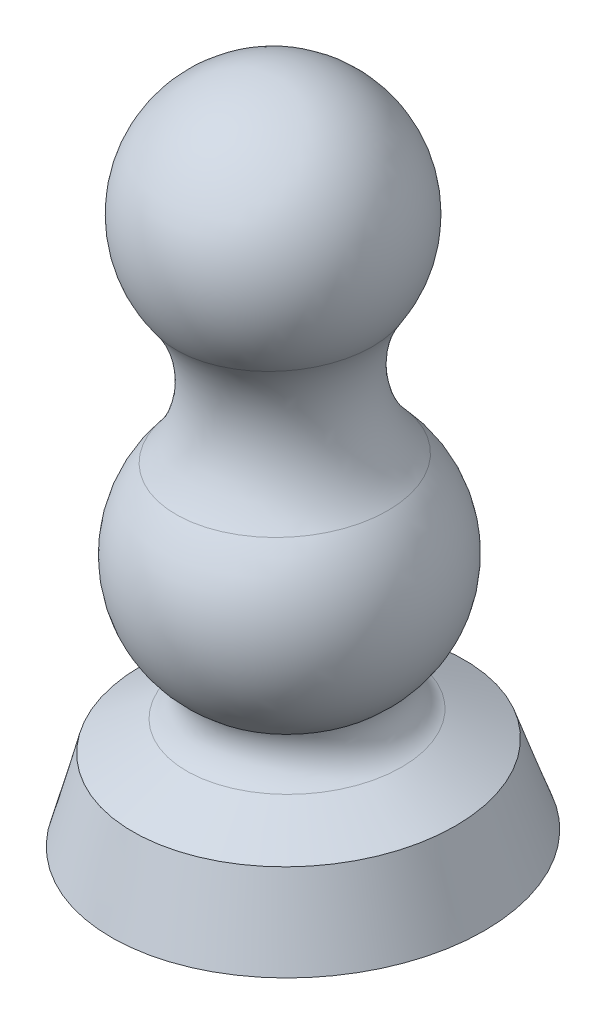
SolidWorks part; units mm, degrees
ref_plane "Front Plane" through (0, 0, 0) normal (0, 0, 1) x (1, 0, 0)
ref_plane "Top Plane" through (0, 0, 0) normal (0, 1, 0) x (1, 0, 0)
ref_plane "Right Plane" through (0, 0, 0) normal (1, 0, 0) x (0, 0, -1)
sketch "Sketch1" plane through (0, 0, 0) normal (0, 0, 1) x (1, 0, 0)
  line L0 (0, 0) -> (-54.2574, 0)
  line L1 (-54.2574, 0) -> (-48.2435, 23.546)
  line L2 (-48.2435, 23.546) -> (-33.1403, 32.5038)
  line L3 (-9.095, 74.0247) -> (-9.095, 88.6743) construction
  line L4 (0, 0) -> (-11.109, 195.0577)
  arc A0 (-33.1403, 32.5038) -> (-28.8283, 44.612) centre (-38.2698, 41.1524) ccw
  arc A2 (-28.8283, 44.612) -> (-36.303, 96.7014) centre (-9.095, 74.0247) cw
  arc A3 (-36.303, 96.7014) -> (-36.303, 137.0192) centre (-60.4901, 116.8603) ccw
  arc A4 (-36.303, 137.0192) -> (-11.109, 195.0577) centre (-9.095, 159.6959) cw
revolve "Revolve2" add sketch "Sketch1" angle 360 about L4
